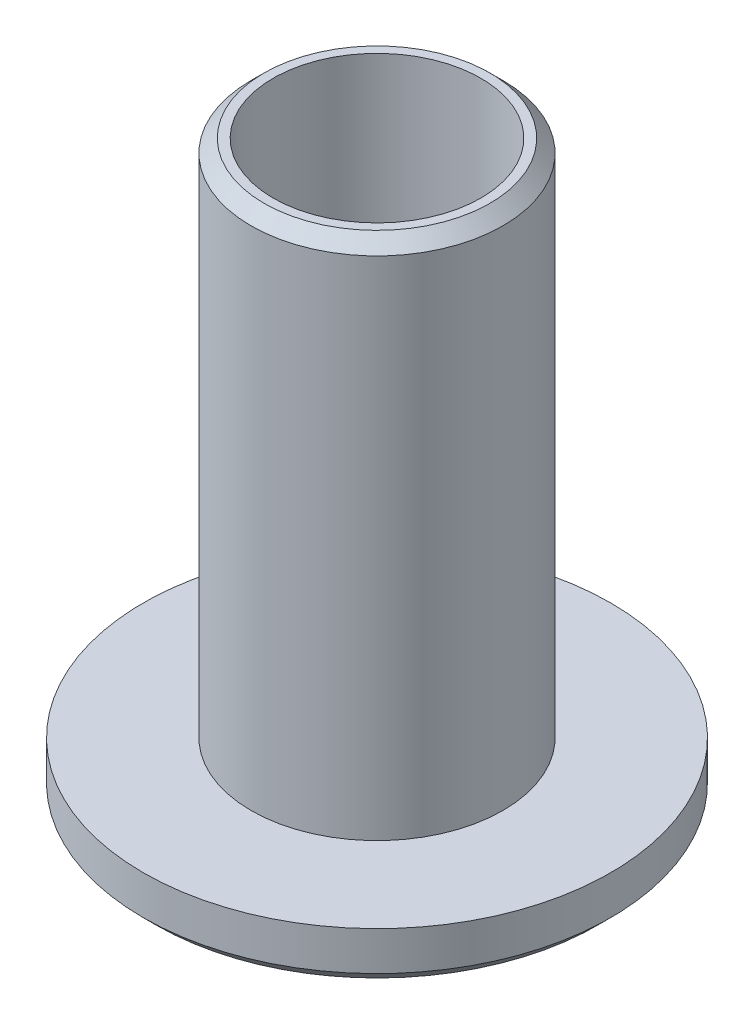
SolidWorks part; units mm, degrees
ref_plane "Ebene vorne" through (0, 0, 0) normal (0, 0, 1) x (1, 0, 0)
ref_plane "Ebene oben" through (0, 0, 0) normal (0, 1, 0) x (1, 0, 0)
ref_plane "Ebene rechts" through (0, 0, 0) normal (1, 0, 0) x (0, 0, -1)
sketch "Skizze1" plane through (0, 0, 0) normal (0, 1, 0) x (1, 0, 0)
  circle A0 centre (0, 0) radius 9
  circle A1 centre (0, 0) radius 4
  dimension "D1" = 18
  dimension "D2" = 8
extrude "Aufsatz-Linear austragen1" add sketch "Skizze1" along normal blind 2
sketch "Skizze2" plane through (0, 2, 0) normal (0, 1, 0) x (1, 0, 0)
  circle A0 centre (0, 0) radius 4 construction
  circle A1 centre (0, 0) radius 4
  circle A2 centre (0, 0) radius 4.85
  dimension "D1" = 9.7
extrude "Aufsatz-Linear austragen2" add sketch "Skizze2" along normal blind 20
chamfer "Fase1" distance 0.5 angle 45 2 edges at (0, 0, 9) (0, 22, 4.85)
